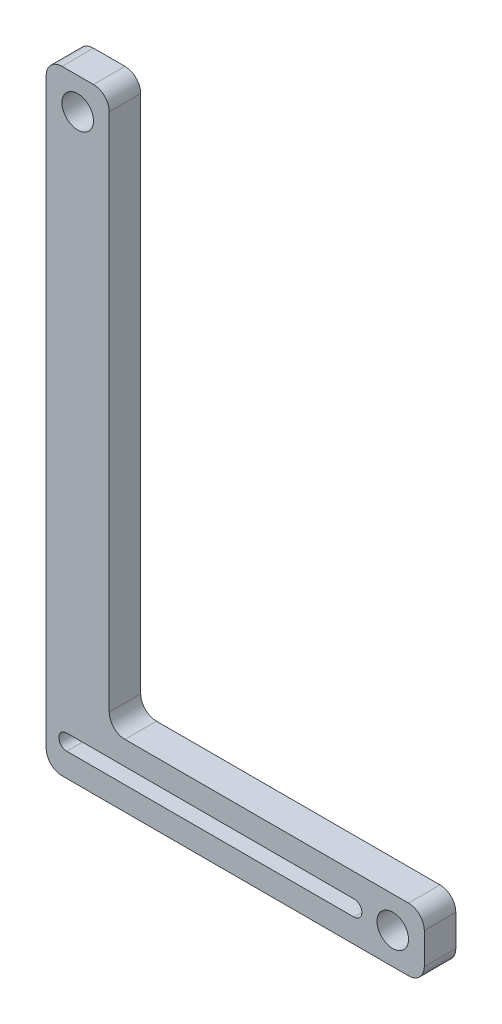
SolidWorks part; units mm, degrees
ref_plane "Front Plane" through (0, 0, 0) normal (0, 0, 1) x (1, 0, 0)
ref_plane "Top Plane" through (0, 0, 0) normal (0, 1, 0) x (1, 0, 0)
ref_plane "Right Plane" through (0, 0, 0) normal (1, 0, 0) x (0, 0, -1)
sketch "Sketch1" plane through (0, 0, 0) normal (0, 0, 1) x (1, 0, 0)
  line L1 (-151.6202, 247.65) -> (-126.2202, 247.65)
  line L2 (-151.6202, 247.65) -> (-151.6202, 0)
  line L3 (-151.6202, 0) -> (-126.2202, 0)
  line L4 (-126.2202, 247.65) -> (-126.2202, 25.4)
  line L5 (-151.6202, 0) -> (0.7798, 0)
  line L6 (-151.6202, 0) -> (-151.6202, 25.4)
  line L7 (-126.2202, 25.4) -> (0.7798, 25.4)
  line L8 (0.7798, 0) -> (0.7798, 25.4)
  circle A1 centre (-11.9202, 12.7) radius 6.35
  circle A2 centre (-138.9202, 234.95) radius 6.35
  dimension "D4" = 12.7
  dimension "D5" = 12.7
  dimension "D1" = 25.4
  dimension "D2" = 152.4
  dimension "D3" = 25.4
  dimension "D6" = 12.7
  dimension "D7" = 12.7
  dimension "D8" = 247.65
extrude "Boss-Extrude1" add sketch "Sketch1" against normal blind 12.7 contours L5 L8 L7 L4 L1 L2 L3 A1 A2
fillet "Fillet1" radius 6.35 6 edges at (0.7798, 0, -6.35) (0.7798, 25.4, -6.35) (-151.6202, 0, -6.35) (-126.2202, 25.4, -6.35) (-151.6202, 247.65, -6.35) (-126.2202, 247.65, -6.35)
sketch "Sketch2" plane through (0, 0, -12.7) normal (0, 0, -1) x (-1, 0, 0)
  line L0 (27.5413, 12.7) -> (143.3605, 12.7) construction
  line L1 (27.5413, 15.875) -> (143.3605, 15.875)
  line L2 (27.5413, 9.525) -> (143.3605, 9.525)
  line L3 (-0.7798, 6.35) -> (-0.7798, 19.05) construction
  arc A0 (27.5413, 15.875) -> (27.5413, 9.525) centre (27.5413, 12.7) ccw
  arc A1 (143.3605, 9.525) -> (143.3605, 15.875) centre (143.3605, 12.7) ccw
  point P2 (85.4509, 12.7)
  point P7 (-0.7798, 12.7)
  dimension ".5" = 6.35
extrude "Cut-Extrude1" cut sketch "Sketch2" against normal blind 12.7
